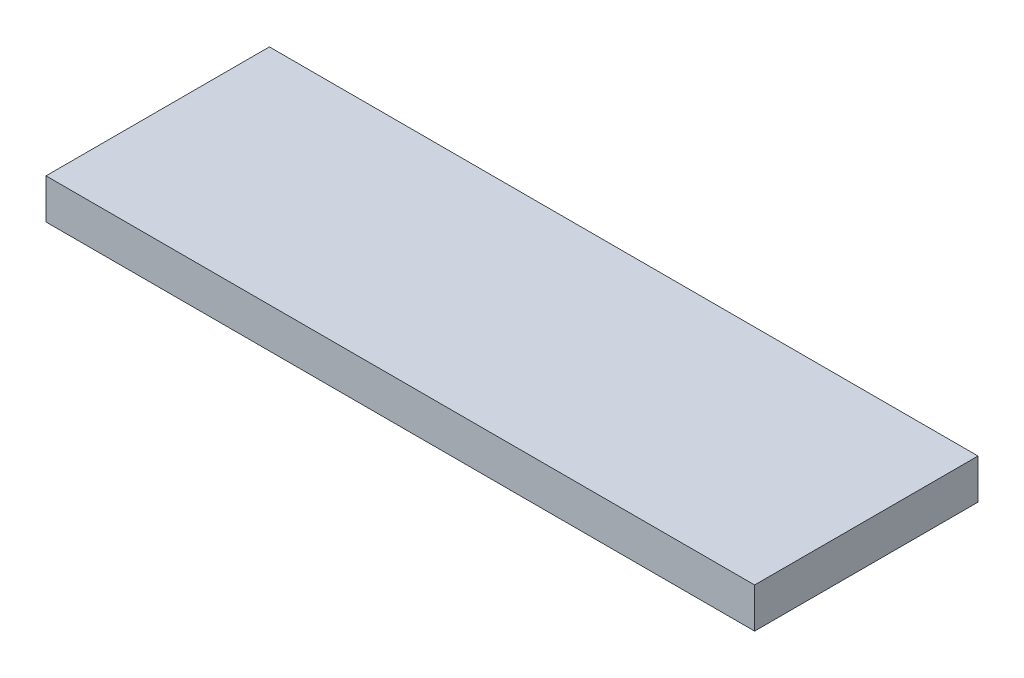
SolidWorks part; units mm, degrees
ref_plane "Front Plane" through (0, 0, 0) normal (0, 0, 1) x (1, 0, 0)
ref_plane "Top Plane" through (0, 0, 0) normal (0, 1, 0) x (1, 0, 0)
ref_plane "Right Plane" through (0, 0, 0) normal (1, 0, 0) x (0, 0, -1)
sketch "Sketch1" plane through (0, 0, 0) normal (0, 0, 1) x (1, 0, 0)
  line L1 (0, 0) -> (415.7614, 0)
  line L2 (0, 0) -> (0, 23.4583)
  line L3 (0, 23.4583) -> (415.7614, 23.4583)
  line L4 (415.7614, 0) -> (415.7614, 23.4583)
extrude "Extrude1" add sketch "Sketch1" along normal blind 131.064
